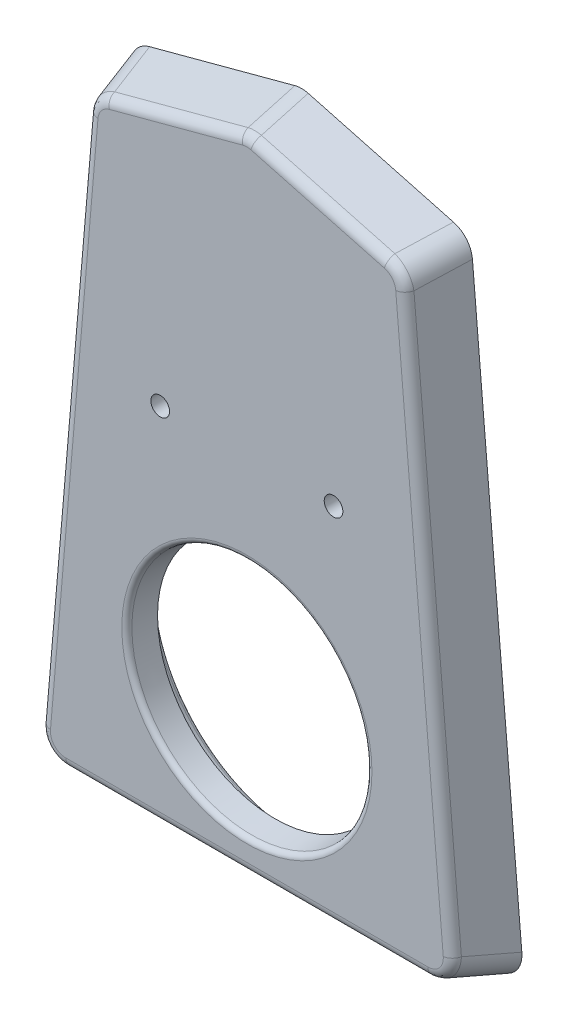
SolidWorks part; units mm, degrees
ref_plane "Plan1" through (0, 0, 0) normal (0, 0, 1) x (1, 0, 0)
ref_plane "Plan2" through (0, 0, 0) normal (0, 1, 0) x (1, 0, 0)
ref_plane "Plan3" through (0, 0, 0) normal (1, 0, 0) x (0, 0, -1)
sketch "Esquisse1" plane through (0, 0, 0) normal (0, 0, 1) x (1, 0, 0)
  line L0 (0, 438.7032) -> (0, -2161.2968) construction
  line L1 (0, 0) -> (-83.5, 0)
  line L2 (-83.5, 0) -> (-63.5, 232.9852)
  line L3 (-63.5, 232.9852) -> (0, 250)
  line L4 (0, 0) -> (83.5, 0)
  line L5 (83.5, 0) -> (63.5, 232.9852)
  line L6 (63.5, 232.9852) -> (0, 250)
  line L7 (-83.5, 0) -> (-83.5, 134.163) construction
  line L8 (0, 250) -> (-100.7793, 250) construction
  dimension "D6" = 15
  dimension "D1" = 83.5
  dimension "D2" = 250
  dimension "D3" = 127
extrude "Base-Extrusion" add sketch "Esquisse1" along normal blind 20.5 draft 15
sketch "Esquisse2" plane through (0, 0, 0) normal (0, 0, -1) x (-1, 0, 0)
  circle A0 centre (0, 61.5) radius 54.5
  dimension "D1" = 7
  dimension "D2" = 109
extrude "Enlèv. mat.-Extru.1" cut sketch "Esquisse2" against normal blind 10 draft 9
sketch "Esquisse3" plane through (0, 0, 10) normal (0, 0, -1) x (-1, 0, 0)
  circle A0 centre (0, 61.5) radius 44
  circle A1 centre (0, 61.5) radius 54.5 construction
  dimension "D1" = 88
extrude "Enlèv. mat.-Extru.2" cut sketch "Esquisse3" against normal through all draft 6
sketch "Esquisse4" plane through (0, 0, 0) normal (0, 0, -1) x (-1, 0, 0)
  circle A0 centre (0, 176) radius 55
  dimension "D1" = 110
  dimension "D2" = 121
extrude "Enlèv. mat.-Extru.3" cut sketch "Esquisse4" against normal blind 1.5 draft 5
sketch "Esquisse5" plane through (0, 0, 0) normal (0, 0, -1) x (-1, 0, 0)
  line L0 (83.5, 0) -> (-83.5, 0) construction
  line L1 (0, -550) -> (0, 105.5) construction
  line L2 (0, 121) -> (0, 2680) construction
  circle A0 centre (66.5, 15) radius 1.7
  circle A1 centre (52.4, 222.4) radius 1.7
  circle A2 centre (0, 61.5) radius 44 construction
  circle A3 centre (0, 176) radius 55 construction
  circle A4 centre (-52.4, 222.4) radius 1.7
  circle A5 centre (-66.5, 15) radius 1.7
  dimension "D1" = 66.5
  dimension "D3" = 3.4
  dimension "D4" = 3.4
  dimension "D5" = 207.4
  dimension "D2" = 15
  dimension "D6" = 52.4
extrude "Enlèv. mat.-Extru.4" cut sketch "Esquisse5" against normal blind 15 draft 1
fillet "Congé5" radius 10 5 edges at (-60.9283, 230.8309, 10.25) (0, 247.1566, 10.25) (60.9283, 230.8309, 10.25) (80.5077, 2.7465, 10.25) (-80.5077, 2.7465, 10.25)
fillet "Congé6" radius 4 10 edges at (-27.1562, 237.0368, 20.5) (27.1562, 237.0368, 20.5) (0, 5.493, 20.5) (67.7757, 118.9523, 20.5) (-67.7757, 118.9523, 20.5) (-74.1604, 8.5723, 20.5) (74.1604, 8.5723, 20.5) (56.7288, 227.3129, 20.5) (-56.7288, 227.3129, 20.5) (0, 243.9729, 20.5)
fillet "Congé7" radius 2 3 edges at (-52.9162, 61.5, 10) (-54.5, 61.5, 0) (-45.1036, 61.5, 20.5)
fillet "Congé8" radius 1 1 edges at (-54.8688, 176, 1.5)
sketch "Esquisse6" plane through (0, 0, 1.5) normal (0, 0, -1) x (-1, 0, 0)
  line L1 (0, 2740) -> (0, -180) construction
  circle A0 centre (-32.5, 140.5) radius 3.5
  circle A3 centre (32.5, 140.5) radius 3.5
  dimension "D1" = 7
  dimension "D3" = 140.5
  dimension "D2" = 65
extrude "Enlèv. mat.-Extru.5" cut sketch "Esquisse6" against normal through all
fillet "Congé11" radius 0.5 1 edges at (-55, 176, 0)
